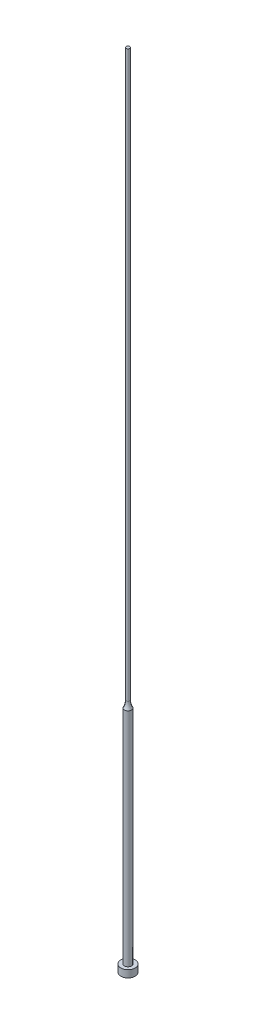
SolidWorks part; units mm, degrees
ref_plane "Front Plane" through (0, 0, 0) normal (0, 0, 1) x (1, 0, 0)
ref_plane "Top Plane" through (0, 0, 0) normal (0, 1, 0) x (1, 0, 0)
ref_plane "Right Plane" through (0, 0, 0) normal (1, 0, 0) x (0, 0, -1)
sketch "Sketch2" plane through (0, 0, 0) normal (0, 0, 1) x (1, 0, 0)
  line L0 (0, 0) -> (3.175, 0)
  line L1 (55, 0) -> (-55, 0) construction
  line L2 (3.175, 0) -> (3.175, 3.175)
  line L3 (3.175, 3.175) -> (1.5875, 3.175)
  line L4 (1.5875, 3.175) -> (1.5875, 101.6)
  line L5 (1.5875, 101.6) -> (0.7938, 101.6)
  line L6 (0.7938, 101.6) -> (0.7938, 355.6)
  line L7 (0.7938, 355.6) -> (0, 355.6)
  line L8 (0, 355.6) -> (0, 0)
  dimension "D1" = 3.175
  dimension "D2" = 3.175
  dimension "D3" = 1.5875
  dimension "D4" = 101.6
  dimension "D5" = 0.7937
  dimension "D6" = 355.6
revolve "Revolve1" add sketch "Sketch2" angle 360 about L8
fillet "Fillet1" radius 6.35 1 edges at (-0.7938, 101.6, 0)
